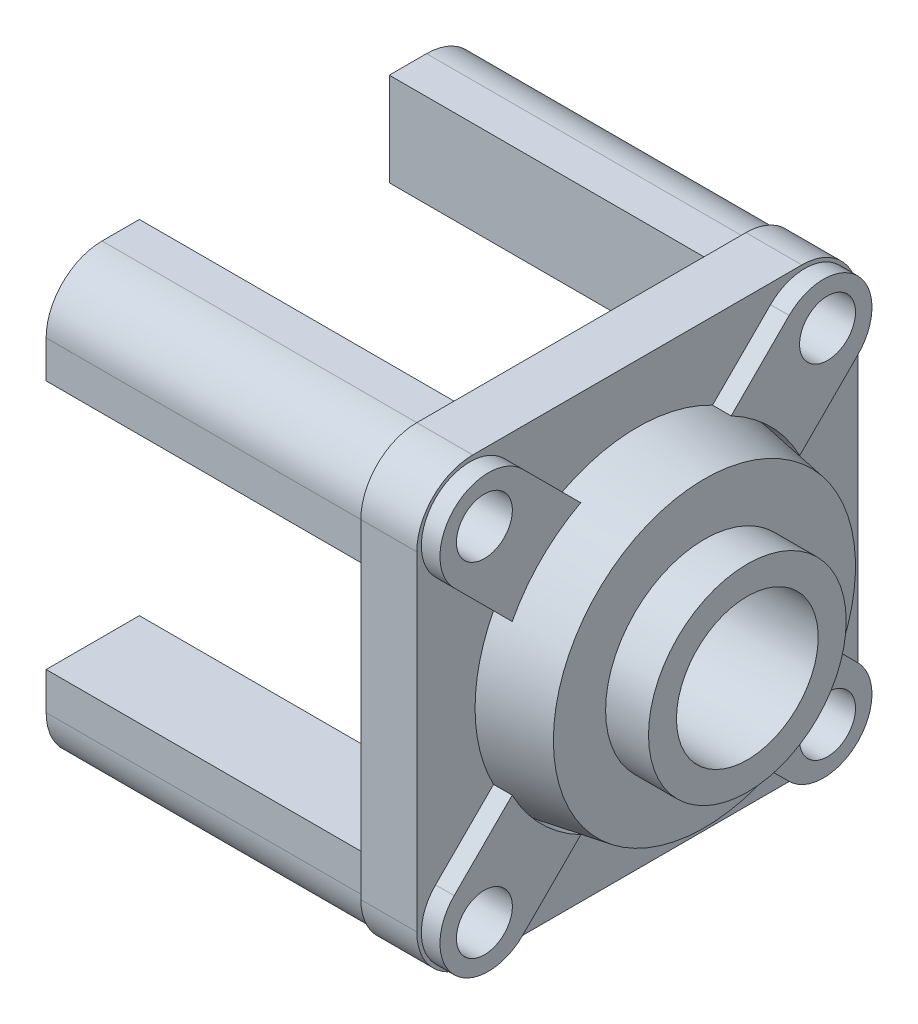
SolidWorks part; units mm, degrees
ref_plane "Front Plane" through (0, 0, 0) normal (0, 0, 1) x (1, 0, 0)
ref_plane "Top Plane" through (0, 0, 0) normal (0, 1, 0) x (1, 0, 0)
ref_plane "Right Plane" through (0, 0, 0) normal (1, 0, 0) x (0, 0, -1)
sketch "Sketch3" plane through (0, 0, 0) normal (0, 0, 1) x (1, 0, 0)
  line L0 (0, 118) -> (30, 118)
  line L1 (30, 118) -> (30, 87)
  line L2 (30, 87) -> (66, 81)
  line L3 (66, 81) -> (66, 53)
  line L4 (66, 53) -> (89, 53)
  line L5 (89, 53) -> (89, 38)
  line L6 (89, 38) -> (8, 38)
  line L7 (0, 81) -> (0, 118)
  line L8 (0, 0) -> (89, 0) construction
  line L9 (0, 81) -> (8, 81)
  line L10 (8, 81) -> (8, 38)
  dimension "D1" = 30
  dimension "D2" = 31
  dimension "D3" = 38
  dimension "D4" = 53
  dimension "D5" = 89
  dimension "D6" = 66
  dimension "D7" = 81
  dimension "D8" = 8
  dimension "D9" = 87
  dimension "D10" = 81
revolve "Revolve1" add sketch "Sketch3" angle 360 about L8
sketch "Sketch4" plane through (0, 0, 0) normal (-1, 0, 0) x (0, 0, 1)
  line L1 (118.25, -118.25) -> (-118.25, -118.25)
  line L2 (118.25, -118.25) -> (118.25, 118.25)
  line L3 (118.25, 118.25) -> (-118.25, 118.25)
  line L4 (-118.25, -118.25) -> (-118.25, 118.25)
  line L5 (118.25, -118.25) -> (-118.25, 118.25) construction
  line L6 (118.25, 118.25) -> (-118.25, -118.25) construction
  circle A0 centre (0, 0) radius 118
  circle A1 centre (0, 0) radius 118 construction
  point P0 (0, 0)
  dimension "D1" = 236.5
extrude "Boss-Extrude2" add sketch "Sketch4" against normal blind 30
sketch "Sketch5" plane through (30, 0, 0) normal (1, 0, 0) x (0, 0, -1)
  line L0 (0, 0) -> (118.25, 118.25) construction
  line L1 (108.2044, 71.4348) -> (77.0917, 40.3221)
  line L4 (71.4348, 108.2044) -> (40.3221, 77.0917)
  line L5 (108.2044, 71.4348) -> (40.3221, 77.0917) construction
  line L6 (77.0917, 40.3221) -> (71.4348, 108.2044) construction
  arc A0 (40.3221, 77.0917) -> (77.0917, 40.3221) centre (0, 0) cw
  circle A1 centre (0, 0) radius 87 construction
  arc A2 (108.2044, 71.4348) -> (71.4348, 108.2044) centre (89.8196, 89.8196) ccw
  point P5 (74.2632, 74.2632)
  dimension "D2" = 26
  dimension "D1" = 52
  dimension "D3" = 44
extrude "Boss-Extrude3" add sketch "Sketch5" along normal blind 10
sketch "Sketch6" plane through (40, 0, 0) normal (1, 0, 0) x (0, 0, -1)
  line L0 (92, 92) -> (0, 0) construction
  line L1 (0, 0) -> (0, 118.25) construction
  line L2 (-118.25, 118.25) -> (118.25, 118.25) construction
  circle A0 centre (92, 92) radius 15
  dimension "D1" = 45
  dimension "D2" = 30
  dimension "D3" = 92
extrude "Cut-Extrude1" cut sketch "Sketch6" against normal through all
pattern_circular "CirPattern1" count 4 over 360 about axis through (0, 0, 0) along (1, 0, 0) of "Boss-Extrude3", "Cut-Extrude1"
sketch "Sketch7" plane through (0, 0, 0) normal (-1, 0, 0) x (0, 0, 1)
  line L1 (-117, 67) -> (-67, 67)
  line L2 (-117, 67) -> (-117, 117)
  line L3 (-117, 117) -> (-67, 117)
  line L4 (-67, 67) -> (-67, 117)
  line L5 (-117, 67) -> (-67, 117) construction
  line L6 (-117, 117) -> (-67, 67) construction
  point P0 (-92, 92)
  dimension "D1" = 50
extrude "Boss-Extrude4" add sketch "Sketch7" along normal blind 170
pattern_circular "CirPattern2" count 4 over 360 about axis through (0, 0, 0) along (1, 0, 0) of "Boss-Extrude4"
fillet "Fillet1" radius 30 8 edges at (-85, -117, 117) (15, -118.25, 118.25) (-85, -117, -117) (15, -118.25, -118.25) (-85, 117, -117) (15, 118.25, -118.25) (-85, 117, 117) (15, 118.25, 118.25)
